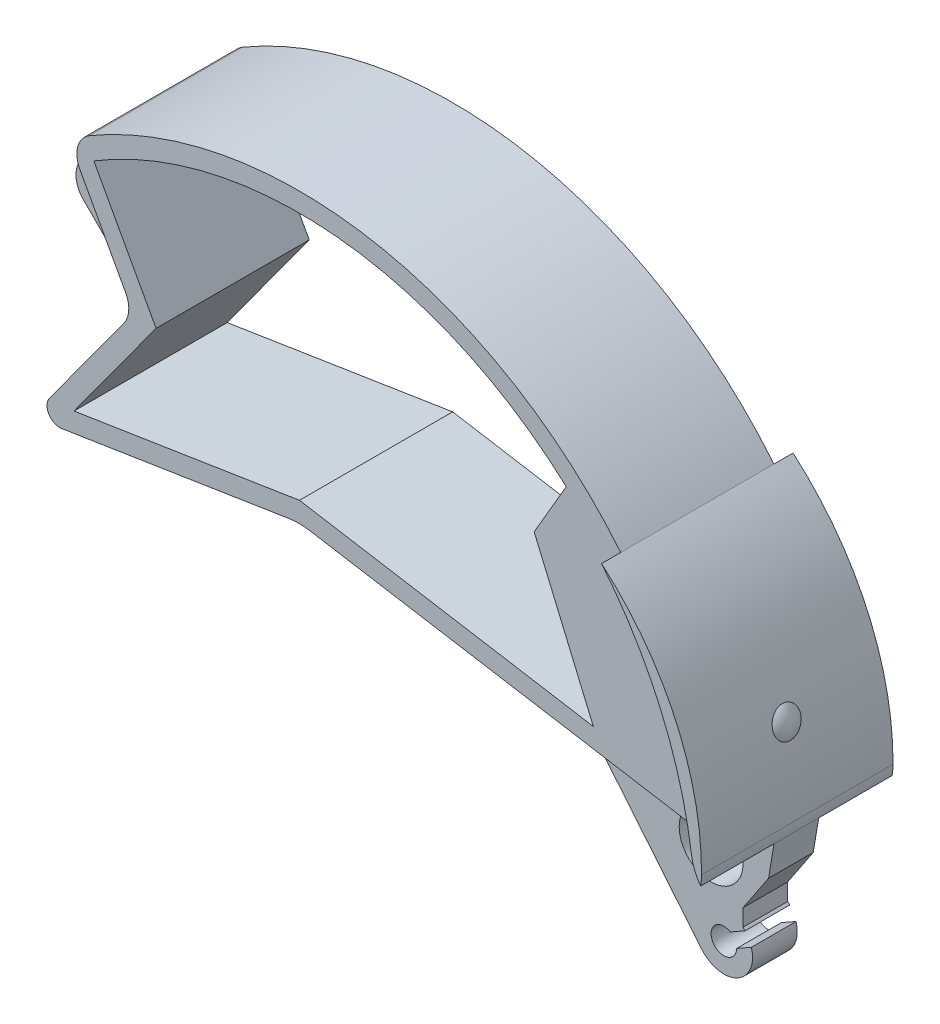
SolidWorks part; units mm, degrees
ref_plane "Plan1" through (0, 0, 0) normal (0, 0, 1) x (1, 0, 0)
ref_plane "Plan2" through (0, 0, 0) normal (0, 1, 0) x (1, 0, 0)
ref_plane "Plan3" through (0, 0, 0) normal (1, 0, 0) x (0, 0, -1)
sketch "Esquisse1" plane through (0, 0, 0) normal (0, 0, 1) x (1, 0, 0)
  line L0 (-30.062, 0) -> (60, 0) construction
  line L1 (0, 0) -> (0, 20) construction
  line L2 (0, 0) -> (0, -23.1494) construction
  line L3 (0, 10) -> (15, 7.5)
  line L4 (0, 10) -> (-21, 6.7)
  line L6 (-21, 6.7) -> (-13, 17.6831)
  line L7 (-13, 17.6831) -> (-18.0901, 27)
  line L8 (32.5, 0) -> (30.5, -2.9981)
  line L9 (15, 7.5) -> (27.2613, -7.4281)
  line L10 (29, -6) -> (35.2996, -2.4302) construction
  line L11 (30.5, -2.9981) -> (30.5, -4.3229)
  line L13 (30, -6.008) -> (31.1551, -5.3535)
  line L14 (29.507, -5.138) -> (30.6621, -4.4834)
  arc A0 (29.507, -5.138) -> (30, -6.008) centre (29, -6) ccw
  arc A1 (32.5, 0) -> (-18.0901, 27) centre (0, 0) ccw
  circle A2 centre (28, 0) radius 2.5
  arc A3 (27.2613, -7.4281) -> (31.1551, -5.3535) centre (29, -6) ccw
  arc A4 (30.6621, -4.4834) -> (30.5, -4.3229) centre (29, -6) ccw
  dimension "D2" = 2
  dimension "D4" = 65
  dimension "D5" = 5
  dimension "D9" = 4.5
  dimension "D1" = 20
  dimension "D3" = 28
  dimension "D7" = 6
  dimension "D8" = 1
  dimension "D10" = 15
  dimension "D11" = 7.5
  dimension "D12" = 6.7
  dimension "D13" = 45
  dimension "D14" = 13
  dimension "D15" = 27
extrude "Base-Extrusion" add sketch "Esquisse1" along normal mid plane 12
sketch "Esquisse3" plane through (0, 0, 6) normal (0, 0, 1) x (1, 0, 0)
  line L0 (0, 0) -> (33.4201, 0) construction
  line L1 (0, 0) -> (-0.5091, 17.9395) construction
  line L4 (15, 7.5) -> (34.3503, 4.2749)
  line L5 (15, 7.5) -> (15, -11.4065)
  line L6 (15, -11.4065) -> (34.3503, -11.4065)
  line L7 (34.3503, -11.4065) -> (34.3503, 4.2749)
extrude "Enlèv. mat.-Extru.1" cut sketch "Esquisse3" against normal blind 4.25
mirror "Symétrie1" about plane through (0, 0, 0) normal (0, 0, 1)
sketch "Esquisse4" plane through (0, 0, 0) normal (0, 0, 1) x (1, 0, 0)
  line L0 (0, 0) -> (0, 34.4252) construction
  line L1 (0, 0) -> (34.6514, 0) construction
  line L10 (0.0071, 11.5195) -> (30.3178, 6.4677)
  line L11 (-17.6554, 8.744) -> (0.0071, 11.5195)
  line L12 (-11.228, 17.5681) -> (-17.6554, 8.744)
  line L13 (-16.1022, 26.49) -> (-11.228, 17.5681)
  line L14 (0.0071, 11.5195) -> (23.0285, 7.6826)
  line L15 (-17.6554, 8.744) -> (0.0071, 11.5195)
  line L16 (-11.228, 17.5681) -> (-17.6554, 8.744)
  line L17 (-16.1022, 26.49) -> (-11.228, 17.5681)
  line L19 (20.9045, 22.8911) -> (18.3894, 18.5734)
  line L20 (18.3894, 18.5734) -> (23.0285, 7.6826)
  arc A2 (30.3178, 6.4677) -> (-16.1022, 26.49) centre (0, 0) ccw
  arc A3 (20.9045, 22.8911) -> (-16.1022, 26.49) centre (0, 0) ccw
  dimension "D1" = 1.5
extrude "Enlèv. mat.-Extru.2" cut sketch "Esquisse4" against normal mid plane 184.25
sketch "Esquisse5" plane through (0, 0, 0) normal (0, 0, 1) x (1, 0, 0)
  line L0 (0, 0) -> (41.641, 0) construction
  line L1 (0, 0) -> (0, 36.6826) construction
  line L2 (32.5, 0) -> (32.9928, 2.9297)
  arc A0 (32.9928, 2.9297) -> (25.1707, 20.5593) centre (10.5, 3.5) ccw
  arc A1 (32.1672, 4.6388) -> (-18.0901, 27) centre (0, 0) ccw construction
  arc A2 (32.5, 0) -> (25.1707, 20.5593) centre (0, 0) ccw
  dimension "D3" = 45
  dimension "D1" = 10.5
  dimension "D2" = 3.5
extrude "Boss.-Extru.1" add sketch "Esquisse5" along normal mid plane 15
fillet "Congé1" radius 5
fillet "Congé2" radius 4
fillet "Congé4" radius 2
fillet "Congé5" radius 5
fillet "Congé6" radius 1
sketch "Esquisse6" plane through (0, 0, 0) normal (0, 0, 1) x (1, 0, 0)
  line L0 (0, 0) -> (15.8902, 0) construction
  line L1 (0, 0) -> (0, 36.5815) construction
  line L2 (-17.1878, 25.3486) -> (-13.6076, 18.7951) construction
  line L3 (-16.6141, 24.2984) -> (-13.6076, 18.7951)
  line L4 (-13.7461, 16.6587) -> (-19.5786, 8.6514) construction
  line L5 (-13.7461, 16.6587) -> (-14.3385, 15.8454)
  line L6 (-14.3385, 15.8454) -> (-19.417, 20.9441)
  line L7 (-19, 22.3555) -> (-19, 24.0876)
  line L9 (-17, 24.0876) -> (-17, 22.3555)
  line L10 (-22.4138, 21.6619) -> (-2.086, 24.8563) construction
  line L11 (-18, 34.4444) -> (-18, 16.6587) construction
  line L16 (-17, 24.0876) -> (-16.6141, 24.2984)
  arc A0 (-13.7461, 16.6587) -> (-13.6076, 18.7951) centre (-15.3627, 17.8363) ccw construction
  arc A1 (-13.7461, 16.6587) -> (-13.6076, 18.7951) centre (-15.3627, 17.8363) ccw
  arc A2 (-19, 22.3555) -> (-17, 22.3555) centre (-18, 22.3555) ccw
  arc A3 (-19, 24.0876) -> (-19.417, 20.9441) centre (-18, 22.3555) ccw
  dimension "D3" = 2
  dimension "D2" = 18
extrude "Boss.-Extru.2" add sketch "Esquisse6" along normal blind 3.5
sketch "Esquisse7" plane through (0, 0, 0) normal (0, 0, 1) x (1, 0, 0)
  line L0 (0, 0) -> (33.4044, 0) construction
  line L1 (0, 0) -> (35.0755, 10.4539) construction
  line L2 (28.3117, 8.438) -> (32.4472, 9.6706)
  arc A0 (32.4472, 9.6706) -> (28.3117, 8.438) centre (30.3794, 9.0543) ccw
  dimension "D1" = 31.7
revolve "Boss.-Révol.1" add sketch "Esquisse7" angle 360 about L1
